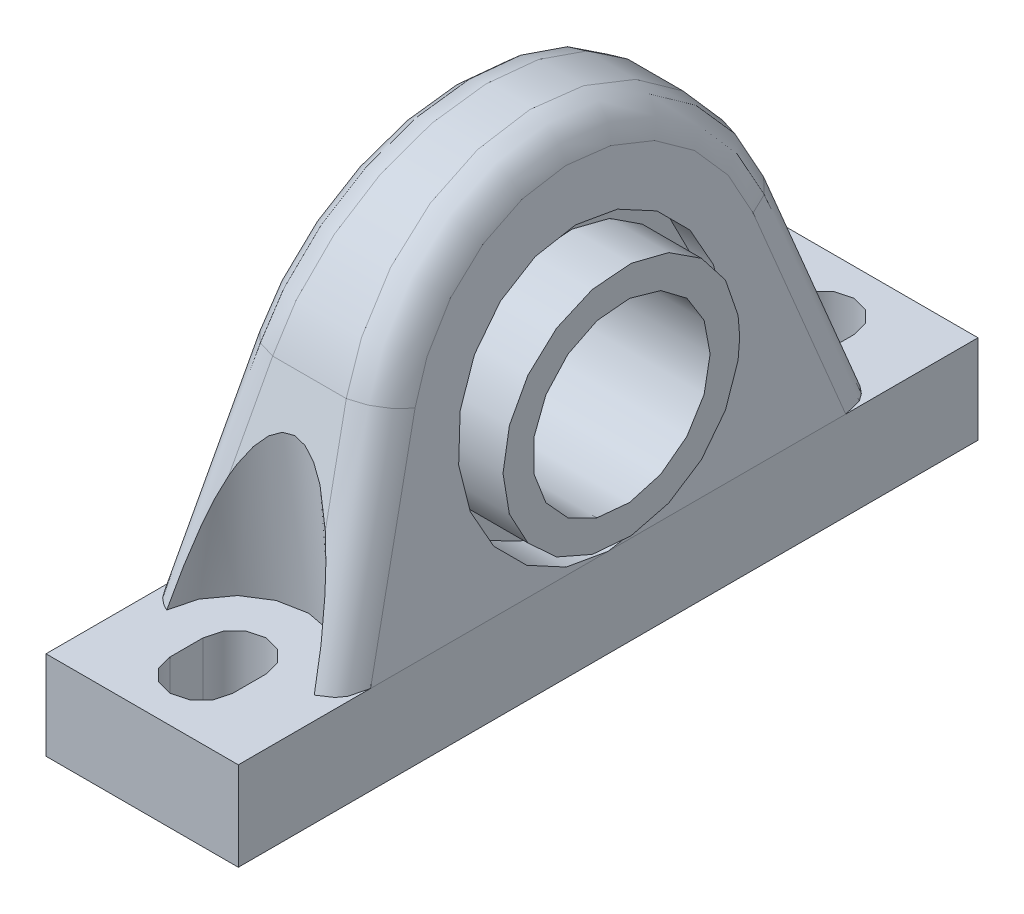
SolidWorks part; units mm, degrees
ref_plane "front" through (0, 0, 0) normal (0, 0, 1) x (1, 0, 0)
ref_plane "top" through (0, 0, 0) normal (0, 1, 0) x (1, 0, 0)
ref_plane "side" through (0, 0, 0) normal (1, 0, 0) x (0, 0, -1)
sketch "Sketch1" plane through (0, 0, 0) normal (1, 0, 0) x (0, 0, -1)
  line L0 (0, 0) -> (0, 89.4558) construction
  line L1 (-79.375, 0) -> (79.375, 0)
  line L2 (79.375, 0) -> (79.375, 19.05)
  line L3 (79.375, 19.05) -> (58.7375, 19.05)
  line L4 (58.7375, 19.05) -> (43.4651, 62.7985)
  line L5 (-58.7375, 19.05) -> (-43.4651, 62.7985)
  line L6 (-79.375, 19.05) -> (-58.7375, 19.05)
  line L7 (-79.375, 0) -> (-79.375, 19.05)
  arc A0 (43.4651, 62.7985) -> (-43.4651, 62.7985) centre (0, 47.625) ccw
  point P12 (0, 0)
  dimension "D1" = 158.75
  dimension "D2" = 93.6625
  dimension "D3" = 47.625
  dimension "D4" = 19.05
  dimension "D5" = 117.475
extrude "Base-Extrude" add sketch "Sketch1" along normal mid plane 41.275
sketch "Sketch3" plane through (0, 0, 79.375) normal (0, 0, 1) x (1, 0, 0)
  line L0 (20.6375, 19.05) -> (11.4762, 93.6625)
  line L1 (20.6375, 93.6625) -> (-20.6375, 93.6625) construction
  line L2 (11.4762, 93.6625) -> (20.6375, 93.6625)
  line L3 (20.6375, 62.7985) -> (20.6375, 93.6625) construction
  line L4 (20.6375, 93.6625) -> (20.6375, 19.05)
  dimension "D1" = 7
extrude "Cut-Extrude1" cut sketch "Sketch3" against normal through all
mirror "Mirror1" about plane through (0, 0, 0) normal (1, 0, 0) of "Cut-Extrude1"
sketch "Sketch4" plane through (0, 0, 0) normal (1, 0, 0) x (0, 0, -1)
  circle A0 centre (0, 47.625) radius 25.4
  dimension "D1" = 50.8
extrude "Boss-Extrude2" add sketch "Sketch4" along normal blind 23.4696
sketch "Sketch5" plane through (23.4696, 0, 0) normal (1, 0, 0) x (0, 0, -1)
  circle A0 centre (0, 47.625) radius 28.575
  circle A1 centre (0, 47.625) radius 25.4
  circle A2 centre (0, 47.625) radius 25.4
  dimension "D2" = 57.15
  dimension "D1" = 0
extrude "Cut-Extrude2" cut sketch "Sketch5" against normal blind 12.7
sketch "Sketch6" plane through (23.4696, 0, 0) normal (1, 0, 0) x (0, 0, -1)
  circle A0 centre (0, 47.625) radius 19.05
  dimension "D1" = 38.1
extrude "Cut-Extrude3" cut sketch "Sketch6" against normal through all
sketch "Sketch7" plane through (-20.6375, 0, 0) normal (-1, 0, 0) x (0, 0, 1)
  circle A0 centre (0, 47.625) radius 25.4 construction
  arc A1 (28.575, 47.625) -> (28.575, 47.625) centre (0, 47.625) ccw
  circle A2 centre (0, 47.625) radius 28.575
  circle A3 centre (0, 47.625) radius 25.4
  dimension "D1" = 0
extrude "Cut-Extrude4" cut sketch "Sketch7" against normal blind 9.525
sketch "Sketch8" plane through (0, 0, 0) normal (0, -1, 0) x (1, 0, 0)
  line L0 (0, -79.375) -> (0, 79.375) construction
  line L1 (20.6375, -79.375) -> (-20.6375, -79.375) construction
  line L2 (20.6375, 79.375) -> (-20.6375, 79.375) construction
  line L3 (6.7437, -59.5312) -> (6.7437, -66.675)
  line L4 (-6.7437, -59.5312) -> (-6.7437, -66.675)
  line L5 (0, 0) -> (43.4591, 0) construction
  line L6 (-6.7437, 59.5312) -> (-6.7437, 66.675)
  line L7 (6.7437, 59.5312) -> (6.7437, 66.675)
  arc A0 (6.7437, -66.675) -> (-6.7437, -66.675) centre (0, -66.675) cw
  arc A1 (6.7437, -59.5312) -> (-6.7437, -59.5312) centre (0, -59.5312) ccw
  arc A3 (6.7437, 59.5312) -> (-6.7437, 59.5312) centre (0, 59.5312) cw
  arc A5 (6.7437, 66.675) -> (-6.7437, 66.675) centre (0, 66.675) ccw
  dimension "D1" = 119.0625
  dimension "D2" = 133.35
  dimension "D3" = 13.4874
extrude "Cut-Extrude5" cut sketch "Sketch8" against normal through all
sketch "Sketch9" plane through (0, 19.05, 0) normal (0, 1, 0) x (-1, 0, 0)
  circle A0 centre (0, 59.5313) radius 15.875
  circle A2 centre (0, -59.5312) radius 15.875
  dimension "D1" = 31.75
extrude "Cut-Extrude6" cut sketch "Sketch9" along normal through all draft 5
fillet "Fillet1" radius 7.62 12 edges at (-18.2463, 19.05, 58.7375) (0, 53.5938, 46.6784) (-18.2463, 19.05, -58.7375) (0, 53.5938, -46.6784) (18.2463, 19.05, 58.7375) (18.2463, 19.05, -58.7375) (17.9517, 40.9242, 51.1013) (17.9517, 40.9242, -51.1013) (11.4762, 93.6625, 0) (-17.9517, 40.9242, -51.1013) (-11.4762, 93.6625, 0) (-17.9517, 40.9242, 51.1013)
fillet "Fillet3" [suppressed] radius 2.54
